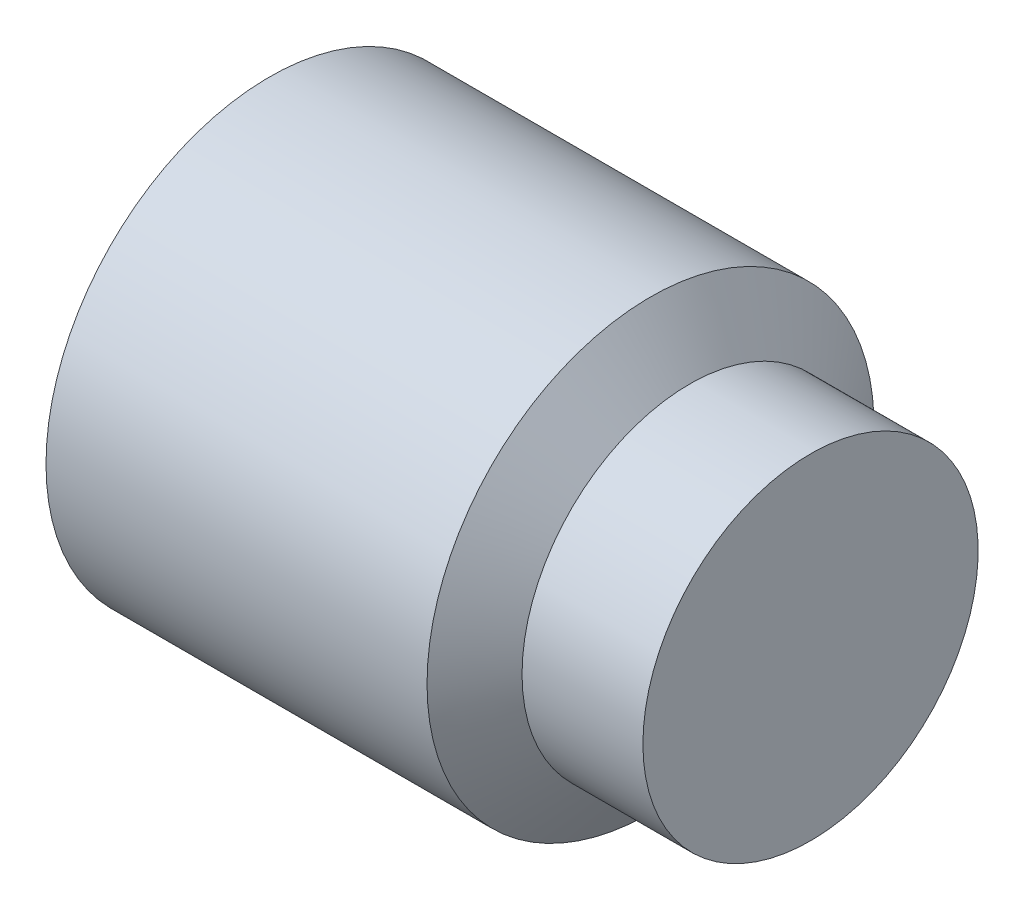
SolidWorks part; units mm, degrees
ref_plane "Plane1" through (0, 0, 0) normal (0, 0, 1) x (1, 0, 0)
ref_plane "Plane2" through (0, 0, 0) normal (0, 1, 0) x (1, 0, 0)
ref_plane "Plane3" through (0, 0, 0) normal (1, 0, 0) x (0, 0, -1)
sketch "BodySke" plane through (0, 0, 0) normal (0, 0, 1) x (1, 0, 0)
  line L0 (0, 0) -> (0, 10.352)
  line L1 (0, 10.352) -> (0.9515, 12)
  line L2 (0.9515, 12) -> (21.4094, 12)
  line L3 (21.4094, 12) -> (23.51, 9)
  line L4 (30, 0) -> (0, 0)
  line L5 (-12.7, 0) -> (88.9, 0) construction
  line L6 (23.51, 9) -> (30, 9)
  line L7 (30, 9) -> (30, 0)
  line L8 (0, -10.352) -> (0.9515, -12) construction
  line L9 (23.51, -9) -> (30, -9) construction
  line L10 (3, 15.875) -> (3, -3.175) construction
  dimension "D1" = 35
  dimension "Length" = 30
  dimension "Diameter" = 24
  dimension "Drive_ch_ang" = 60
  dimension "Minor_dia" = 20.704
  dimension "Dog_dia" = 18
  dimension "Dog_len" = 6.49
  dimension "Advance" = 3
revolve "BaseBody" add sketch "BodySke" angle 360 about L5
sketch "Sketch2" plane through (0, 0, 0) normal (-1, 0, 0) x (0, 0, 1)
  line L0 (3.4641, 6) -> (-3.4641, 6)
  line L1 (-3.4641, 6) -> (-6.9282, 0)
  line L2 (3.4641, 6) -> (6.9282, 0)
  line L3 (3.4641, -6) -> (6.9282, 0)
  line L4 (3.4641, -6) -> (-3.4641, -6)
  line L5 (-3.4641, -6) -> (-6.9282, 0)
  dimension "Hex_size" = 12
  dimension "D2" = 6
  dimension "D3" = 6
extrude "Hex" cut sketch "Sketch2" against normal blind 12
sketch "Sketch4" plane through (0, 4.7709, -0.5249) normal (-1, 0, 0) x (0, 0, 1)
  line L0 (0.5249, -4.7709) -> (8.1959, -4.7709)
  line L1 (0.5249, -4.7709) -> (6.6732, -1.2211) construction
  line L2 (0.5249, -4.7709) -> (4.3604, 1.8724)
  line L3 (6.7899, -3.1774) -> (7.8687, -2.5545)
  line L4 (5.0374, -0.142) -> (6.1162, 0.4809)
  arc A0 (6.7899, -3.1774) -> (5.0374, -0.142) centre (0.5249, -4.7709) ccw
  arc A1 (8.1959, -4.7709) -> (7.8687, -2.5545) centre (0.5249, -4.7709) ccw
  arc A2 (4.3604, 1.8724) -> (6.1162, 0.4809) centre (0.5249, -4.7709) cw
  circle A3 centre (0.5249, -4.7709) radius 6.4645 construction
  circle A4 centre (0.5249, -4.7709) radius 7.671 construction
  dimension "D1" = 30
  dimension "Spline_n_dim" = 12.929
  dimension "Spline_m_dim" = 15.342
  dimension "Spline_a_dim" = 60
  dimension "D3" = 1.7525
  dimension "Spline_p_dim" = 3.505
extrude "Spline6" [suppressed] cut sketch "Sketch4" against normal blind 12
pattern_circular "CirPattern1" [suppressed] count 6 every 60 about axis through (-12.7, 0, 0) along (1, 0, 0)
sketch "Sketch5" plane through (0, 0.4822, 7.7588) normal (-1, 0, 0) x (0, 0, 1)
  line L0 (-7.7588, -0.4822) -> (-0.0878, -0.4822)
  line L1 (-7.7588, -0.4822) -> (-2.7387, 4.538) construction
  line L2 (-7.7588, -0.4822) -> (-7.7588, 7.1888)
  line L3 (-1.9485, 2.8497) -> (-1.2389, 3.5594)
  line L4 (-4.4269, 5.3281) -> (-3.7173, 6.0378)
  line L5 (-4.4269, 5.3281) -> (-1.9485, 2.8497)
  arc A1 (-0.0878, -0.4822) -> (-1.2389, 3.5594) centre (-7.7588, -0.4822) ccw
  arc A2 (-7.7588, 7.1888) -> (-3.7173, 6.0378) centre (-7.7588, -0.4822) cw
  circle A3 centre (-7.7588, -0.4822) radius 6.4645 construction
  circle A4 centre (-7.7588, -0.4822) radius 7.671 construction
  dimension "D1" = 45
  dimension "Spline_n_dim" = 12.929
  dimension "Spline_m_dim" = 15.342
  dimension "Spline_a_dim" = 90
  dimension "D3" = 1.7525
  dimension "Spline_p_dim" = 3.505
extrude "Spline4" [suppressed] cut sketch "Sketch5" against normal blind 12
pattern_circular "CirPattern2" [suppressed] count 4 every 90 about axis through (-12.7, 0, 0) along (1, 0, 0)
sketch "ThdSchSke" plane through (0, 0, 0) normal (0, 0, 1) x (1, 0, 0)
  line L0 (0.9515, -10.352) -> (-0.2025, -12)
  line L1 (0.9515, -10.352) -> (2.1054, -12)
  line L2 (2.1054, -12) -> (2.1054, -15)
  line L3 (-3.175, 0) -> (5.1513, 0) construction
  line L4 (0.9515, 12) -> (0.9515, -12) construction
  line L5 (2.1054, -15) -> (-0.2025, -15)
  line L6 (-0.2025, -15) -> (-0.2025, -12)
  dimension "Thread_minor" = 20.704
  dimension "Diameter" = 24
  dimension "SideAngle" = 55
  dimension "VeeAngle" = 70
  dimension "Overcut" = 30
revolve "ThreadSchematic" [suppressed] cut sketch "ThdSchSke" angle 360 about L3
pattern_linear "ThdSchPat" [suppressed]
equation "\"D2@Sketch2\" = \"Hex_size@Sketch2\" / 2"
equation "\"D3@Sketch2\" = \"Hex_size@Sketch2\" / 2"
equation "\"Thread_minor@ThreadCosmetic\" = \"Minor_dia@BodySke\""
equation "\"D1@Sketch4\" = \"Spline_a_dim@Sketch4\" / 2"
equation "\"D3@Sketch4\" = \"Spline_p_dim@Sketch4\" / 2"
equation "\"D2@CirPattern1\" = \"Spline_a_dim@Sketch4\""
equation "\"Num_teeth@CirPattern1\" = 360 / \"D2@CirPattern1\""
equation "\"Spline_a_dim@Sketch5\" = 90"
equation "\"Spline_p_dim@Sketch5\" = \"Spline_p_dim@Sketch4\""
equation "\"Spline_m_dim@Sketch5\" = \"Spline_m_dim@Sketch4\""
equation "\"Spline_n_dim@Sketch5\" = \"Spline_n_dim@Sketch4\""
equation "\"D1@Sketch5\" = \"Spline_a_dim@Sketch5\" / 2"
equation "\"D3@Sketch5\" = \"Spline_p_dim@Sketch5\" / 2"
equation "\"Key_eng@Spline4\" = \"Key_eng@Spline6\""
equation "\"Thread_minor@ThdSchSke\" = \"Thread_minor@ThreadCosmetic\""
equation "\"Diameter@ThdSchSke\" = \"Diameter@BodySke\""
equation "\"Overcut@ThdSchSke\" = \"Diameter@BodySke\" * 1.25"
equation "\"Num_threads@ThdSchPat\" = int( (\"Length@BodySke\" - ( ( ( \"Diameter@BodySke\" - \"Minor_dia@BodySke\" ) * 0.5 ) / tan( \"Drive_ch_ang@BodySke\" * 0.017453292 ) ) - \"Dog_len@BodySke\" ) / \"Advance@BodySke\" + "
equation "\"Advance@ThdSchPat\" = (\"Length@BodySke\" - ( ( ( \"Diameter@BodySke\" - \"Minor_dia@BodySke\" ) * 0.5 ) / tan( \"Drive_ch_ang@BodySke\" * 0.017453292 ) ) - \"Dog_len@BodySke\" ) /  (\"Num_threads@ThdSchPat\" - 1"
equation "\"Num_threads@ThdSchPat\" = \"Num_threads@ThdSchPat\" - sgn( \"Num_threads@ThdSchPat\" - 1) '---chamfered tips only---"
